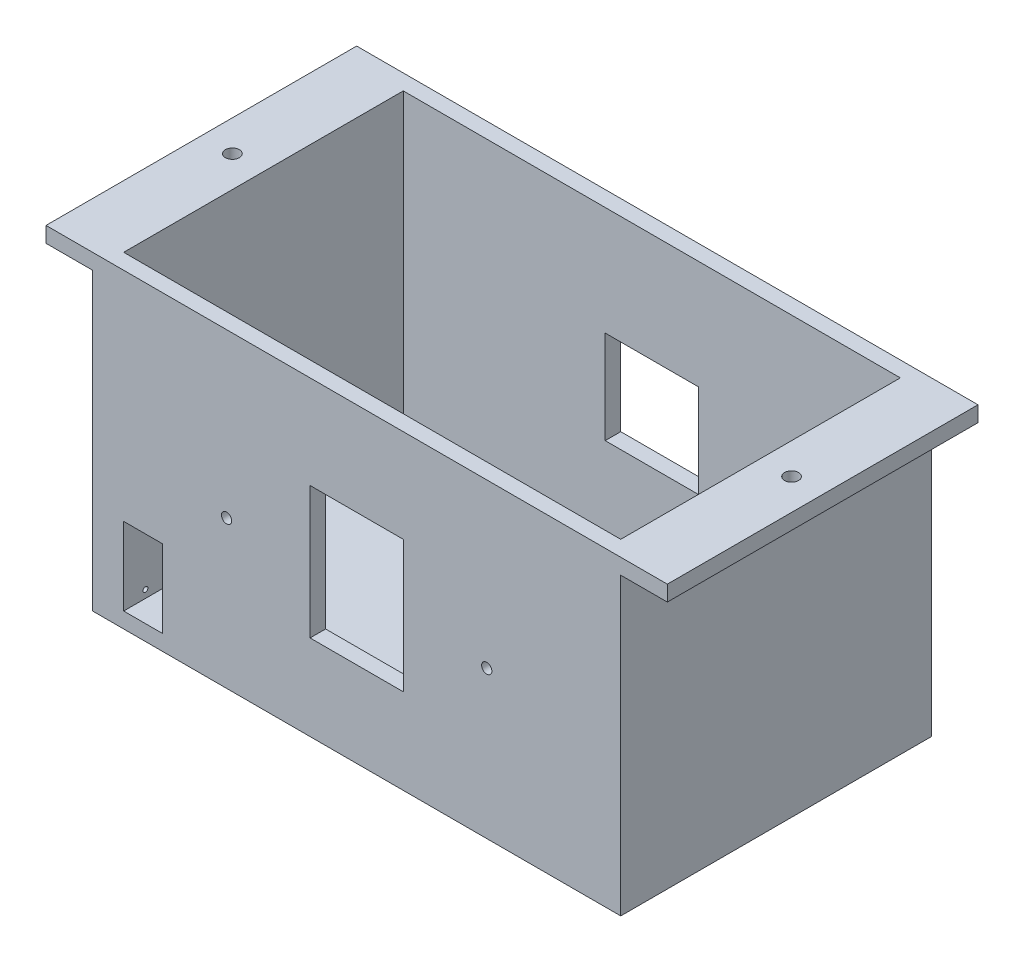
SolidWorks part; units mm, degrees
ref_plane "Front Plane" through (0, 0, 0) normal (0, 0, 1) x (1, 0, 0)
ref_plane "Top Plane" through (0, 0, 0) normal (0, 1, 0) x (1, 0, 0)
ref_plane "Right Plane" through (0, 0, 0) normal (1, 0, 0) x (0, 0, -1)
sketch "Sketch1" plane through (0, 0, 0) normal (0, 1, 0) x (1, 0, 0)
  line L1 (-68.483, 36.6529) -> (131.517, 36.6529)
  line L2 (-68.483, 36.6529) -> (-68.483, -63.3471)
  line L3 (-68.483, -63.3471) -> (131.517, -63.3471)
  line L4 (131.517, 36.6529) -> (131.517, -63.3471)
extrude "Boss-Extrude1" add sketch "Sketch1" along normal blind 100 contours L2 L1 L4 L3
sketch "Sketch2" plane through (0, 100, 0) normal (0, 1, 0) x (1, 0, 0)
  line L0 (-68.483, 36.6529) -> (131.517, 36.6529) construction
  line L1 (-48.483, 31.6529) -> (111.517, 31.6529)
  line L2 (-48.483, 31.6529) -> (-48.483, -58.3471)
  line L3 (-48.483, -58.3471) -> (111.517, -58.3471)
  line L4 (111.517, 31.6529) -> (111.517, -58.3471)
  line L5 (-68.483, 36.6529) -> (-68.483, -63.3471) construction
  dimension "D1" = 160
  dimension "D2" = 90
  dimension "D3" = 5
  dimension "D4" = 20
extrude "Cut-Extrude1" cut sketch "Sketch2" against normal blind 95
sketch "Sketch3" plane through (0, 0, 0) normal (0, -1, 0) x (1, 0, 0)
  line L0 (-68.483, -36.6529) -> (131.517, -36.6529) construction
  line L1 (-68.483, 63.3471) -> (-53.483, 63.3471)
  line L2 (-68.483, 63.3471) -> (-68.483, -36.6529)
  line L3 (-68.483, -36.6529) -> (-53.483, -36.6529)
  line L4 (-53.483, 63.3471) -> (-53.483, -36.6529)
  line L6 (131.517, 63.3471) -> (116.517, 63.3471)
  line L7 (131.517, 63.3471) -> (131.517, -36.6529)
  line L8 (131.517, -36.6529) -> (116.517, -36.6529)
  line L9 (116.517, 63.3471) -> (116.517, -36.6529)
extrude "Cut-Extrude2" cut sketch "Sketch3" against normal blind 95
hole_wizard "#16 (0.177) Diameter Hole1" positions "Sketch6" profile "Sketch5" hole size "#16" standard "ANSI Inch"
sketch "Sketch6" plane through (0, 100, 0) normal (0, 1, 0) x (1, 0, 0)
  line L0 (-68.483, 36.6529) -> (131.517, 36.6529) construction
  line L1 (-68.483, 36.6529) -> (-68.483, -63.3471) construction
  point P0 (-58.483, -13.3471)
  point P2 (121.517, -13.3471)
  dimension "D1" = 180
  dimension "D2" = 50
  dimension "D3" = 10
sketch "Sketch5" plane through (-58.483, 100, 13.3471) normal (1, 0, 0) x (0, 0, 1)
  line L0 (0, 0) -> (0, 100)
  line L1 (0, 100) -> (2.2479, 100)
  line L2 (2.2479, 100) -> (2.2479, 0)
  line L5 (2.2479, 0) -> (0, 0)
  line L11 (0, -6.35) -> (0, 107.95) construction
  dimension "Thru Hole Dia." = 4.4958
  dimension "Thru Hole Depth" = 100
hole_wizard "Tap Drill for M4x0.7 Tap1" positions "Sketch10" profile "Sketch11" hole size "M4x0.7" standard "ANSI Metric"
sketch "Sketch10" plane through (0, 0, 63.3471) normal (0, 0, 1) x (1, 0, 0)
  line L3 (-68.483, 100) -> (-68.483, 95) construction
  line L4 (-68.483, 100) -> (131.517, 100) construction
  point P0 (-10.358, 47.5)
  point P2 (73.392, 47.5)
  dimension "D1" = 83.75
  dimension "D2" = 58.125
  dimension "D3" = 52.5
sketch "Sketch11" plane through (-10.358, 47.5, 63.3471) normal (1, 0, 0) x (0, -1, 0)
  line L0 (0, 0) -> (0, 5)
  line L1 (0, 5) -> (1.65, 5)
  line L2 (1.65, 5) -> (1.65, 0)
  line L5 (1.65, 0) -> (0, 0)
  line L11 (0, -6.35) -> (0, 107.95) construction
  dimension "Thru Hole Dia." = 3.3
  dimension "Thru Hole Depth" = 5
sketch "Sketch12" plane through (0, 0, 63.3471) normal (0, 0, 1) x (1, 0, 0)
  line L0 (131.517, 100) -> (131.517, 95) construction
  line L1 (16.517, 70) -> (46.517, 70)
  line L2 (16.517, 70) -> (16.517, 30)
  line L3 (16.517, 30) -> (46.517, 30)
  line L4 (46.517, 70) -> (46.517, 30)
  line L5 (-68.483, 100) -> (131.517, 100) construction
  point P6 (131.517, 97.5)
  dimension "D1" = 85
  dimension "D2" = 30
  dimension "D3" = 30
  dimension "D4" = 40
sketch "Sketch13" plane through (0, 0, 63.3471) normal (0, 0, 1) x (1, 0, 0)
  line L0 (-68.483, 100) -> (131.517, 100) construction
  line L1 (16.517, 67.5) -> (46.517, 67.5)
  line L2 (16.517, 67.5) -> (16.517, 27.5)
  line L3 (16.517, 27.5) -> (46.517, 27.5)
  line L4 (46.517, 67.5) -> (46.517, 27.5)
  circle A0 centre (73.392, 47.5) radius 1.65 construction
  dimension "D1" = 30
  dimension "D2" = 40
  dimension "D3" = 26.875
  dimension "D4" = 32.5
extrude "Cut-Extrude5" cut sketch "Sketch13" against normal blind 10
sketch "Sketch14" plane through (0, 0, 63.3471) normal (0, 0, 1) x (1, 0, 0)
  line L6 (89.042, 12.5) -> (-25.958, 12.5)
  line L7 (89.042, 12.5) -> (89.042, 87.5)
  line L8 (89.042, 87.5) -> (-25.958, 87.5)
  line L9 (-25.958, 12.5) -> (-25.958, 87.5)
  circle A0 centre (73.392, 47.5) radius 1.65 construction
  dimension "D1" = 35
  dimension "D2" = 15.65
  dimension "D3" = 75
  dimension "D4" = 115
sketch "Sketch16" plane through (-48.483, 0, 0) normal (1, 0, 0) x (0, 0, -1)
  line L1 (-13.3471, 5) -> (-58.3471, 5)
  line L2 (-13.3471, 5) -> (-13.3471, 30)
  line L3 (-13.3471, 30) -> (-58.3471, 30)
  line L4 (-58.3471, 5) -> (-58.3471, 30)
  line L5 (-58.3471, 5) -> (-58.3471, 100) construction
  line L6 (-58.3471, 5) -> (31.6529, 5) construction
  dimension "D1" = 45
  dimension "D2" = 25
  dimension "D3" = 0
  dimension "D4" = 0
extrude "Cut-Extrude4" cut sketch "Sketch12" against normal blind 10
extrude "Boss-Extrude4" add sketch "Sketch16" along normal blind 5
sketch "Sketch18" plane through (0, 0, 63.3471) normal (0, 0, 1) x (1, 0, 0)
  line L0 (-43.483, 5) -> (111.517, 5) construction
  line L1 (-43.483, 30) -> (-30.983, 30)
  line L2 (-43.483, 30) -> (-43.483, 5)
  line L3 (-43.483, 5) -> (-30.983, 5)
  line L4 (-30.983, 30) -> (-30.983, 5)
extrude "Cut-Extrude6" cut sketch "Sketch18" against normal blind 5
hole_wizard "Tap Drill for M2x0.4 Tap1" positions "Sketch19" profile "Sketch20" hole size "M2x0.4" standard "ANSI Metric"
sketch "Sketch19" plane through (-43.483, 0, 0) normal (1, 0, 0) x (0, 0, -1)
  line L0 (-58.3471, 5) -> (-58.3471, 100) construction
  line L1 (-13.3471, 30) -> (-58.3471, 30) construction
  point P0 (-56.3471, 27)
  point P2 (-18.3471, 27)
  point P4 (-18.3471, 7.5)
  point P6 (-56.3471, 7.5)
  dimension "D1" = 38
  dimension "D2" = 38
  dimension "D3" = 2
  dimension "D4" = 2
  dimension "D5" = 3
  dimension "D6" = 3
  dimension "D7" = 19.5
sketch "Sketch20" plane through (-43.483, 27, 56.3471) normal (0, 1, 0) x (0, 0, -1)
  line L0 (0, 0) -> (0, 10)
  line L1 (0, 10) -> (0.8, 10)
  line L2 (0.8, 10) -> (0.8, 0)
  line L5 (0.8, 0) -> (0, 0)
  line L11 (0, -6.35) -> (0, 107.95) construction
  dimension "Thru Hole Dia." = 1.6
  dimension "Thru Hole Depth" = 10
sketch "Sketch21" plane through (0, 0, -36.6529) normal (0, 0, -1) x (-1, 0, 0)
  line L1 (-46.517, 65) -> (-16.517, 65)
  line L2 (-46.517, 65) -> (-46.517, 35)
  line L3 (-46.517, 35) -> (-16.517, 35)
  line L4 (-16.517, 65) -> (-16.517, 35)
  line L6 (-116.517, 95) -> (-116.517, 0) construction
  line L8 (53.483, 0) -> (-116.517, 0) construction
  dimension "D1" = 70
  dimension "D2" = 35
  dimension "D3" = 30
extrude "Cut-Extrude7" cut sketch "Sketch21" against normal blind 10
